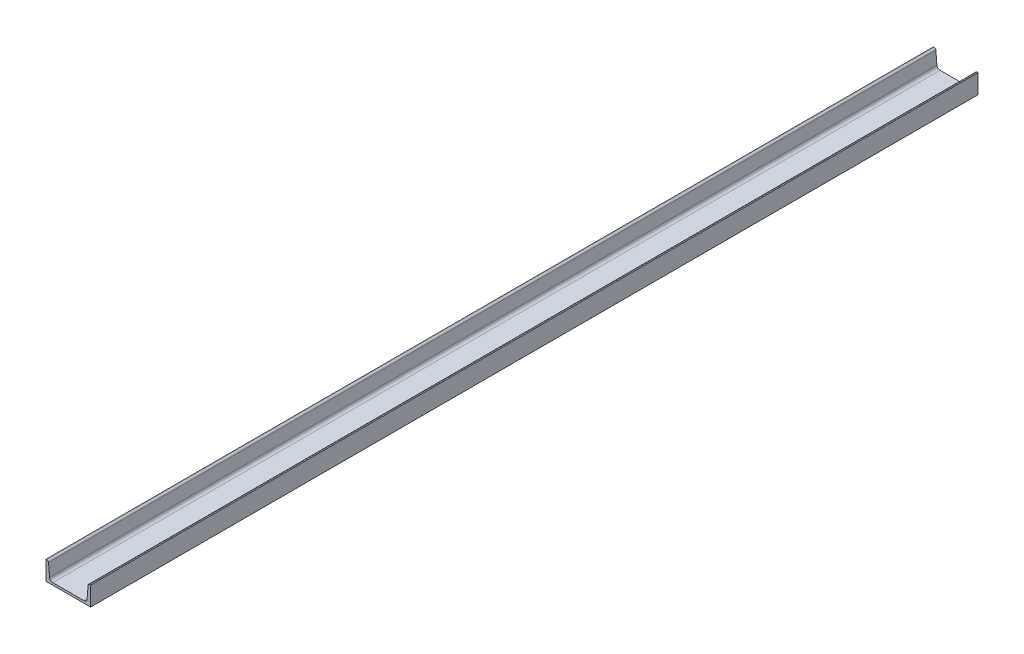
SolidWorks part; units mm, degrees
ref_plane "Plan de face" through (0, 0, 0) normal (0, 0, 1) x (1, 0, 0)
ref_plane "Plan de dessus" through (0, 0, 0) normal (0, 1, 0) x (1, 0, 0)
ref_plane "Plan de droite" through (0, 0, 0) normal (1, 0, 0) x (0, 0, -1)
ref_plane "Plan1" through (0, 0, 1391.5) normal (0, 0, 1) x (1, 0, 0)
sketch "Esquisse1" plane through (0, 0, 1391.5) normal (0, 0, 1) x (1, 0, 0)
  line L0 (48.9281, 7) -> (-48.9281, 7)
  line L1 (-58.8962, 16.2025) -> (-62.0319, 55.3987)
  line L2 (-67.016, 60) -> (-70, 60)
  line L3 (-70, 60) -> (-70, 0)
  line L4 (-70, 0) -> (70, 0)
  line L5 (70, 0) -> (70, 60)
  line L6 (70, 60) -> (67.016, 60)
  line L7 (62.0319, 55.3987) -> (58.8962, 16.2025)
  arc A0 (58.8962, 16.2025) -> (48.9281, 7) centre (48.9281, 17) cw
  arc A1 (-48.9281, 7) -> (-58.8962, 16.2025) centre (-48.9281, 17) cw
  arc A2 (-62.0319, 55.3987) -> (-67.016, 60) centre (-67.016, 55) ccw
  arc A3 (67.016, 60) -> (62.0319, 55.3987) centre (67.016, 55) ccw
extrude "Boss.-Extru.1" add sketch "Esquisse1" against normal blind 2783
